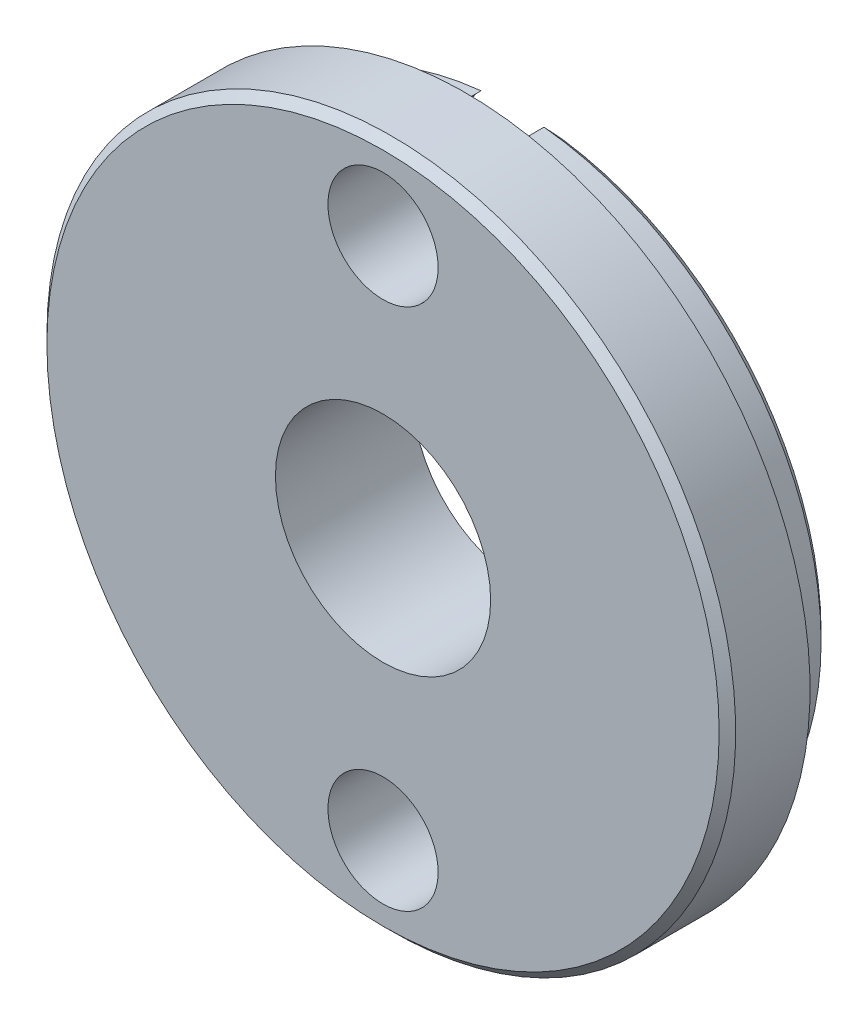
SolidWorks part; units mm, degrees
ref_plane "Front Plane" through (0, 0, 0) normal (0, 0, 1) x (1, 0, 0)
ref_plane "Top Plane" through (0, 0, 0) normal (0, 1, 0) x (1, 0, 0)
ref_plane "Right Plane" through (0, 0, 0) normal (1, 0, 0) x (0, 0, -1)
sketch "Sketch1" plane through (0, 0, 0) normal (0, 0, 1) x (1, 0, 0)
  circle A0 centre (0, 0) radius 15.875 construction
  circle A1 centre (0, 0) radius 15.875
extrude "tab" add sketch "Sketch1" along normal blind 3.81
sketch "Sketch2" plane through (0, 0, 0) normal (0, 0, -1) x (-1, 0, 0)
  circle A0 centre (0, 0) radius 14.224
  circle A1 centre (0, 0) radius 15.875 construction
  dimension "D1" = 1.651
extrude "boss" add sketch "Sketch2" along normal blind 2.54
hole_wizard "7/16-20 Tapped Hole1" positions "Sketch4" profile "Sketch3" tap size "7/16-20" standard "ANSI Inch"
sketch "Sketch4" plane through (0, 0, 3.81) normal (0, 0, 1) x (1, 0, 0)
  point P0 (0, 0)
sketch "Sketch3" plane through (0, 0, 3.81) normal (1, 0, 0) x (0, -1, 0)
  line L0 (0, 0) -> (0, 6.35)
  line L1 (0, 6.35) -> (4.9606, 6.35)
  line L2 (4.9606, 6.35) -> (4.9606, 0)
  line L5 (4.9606, 0) -> (0, 0)
  line L11 (0, -6.35) -> (0, 107.95) construction
  dimension "Thru Tap Drill Dia." = 9.9212
  dimension "Thru Tap Drill Depth" = 6.35
chamfer "Chamfer1" distance 0.381 angle 45 2 edges at (15.875, 0, 3.81) (-14.224, 0, -2.54)
sketch "Sketch5" plane through (0, 0, 3.81) normal (0, 0, 1) x (1, 0, 0)
  line L0 (0, 16.7657) -> (0, -17.4066) construction
  circle A0 centre (0, 0) radius 12.065 construction
  circle A1 centre (0, 12.065) radius 2.54
  circle A2 centre (0, -12.065) radius 2.54
  dimension "D1" = 24.13
  dimension "D2" = 5.08
  dimension "D3" = 5.08
extrude "potting holes" cut sketch "Sketch5" against normal through all
